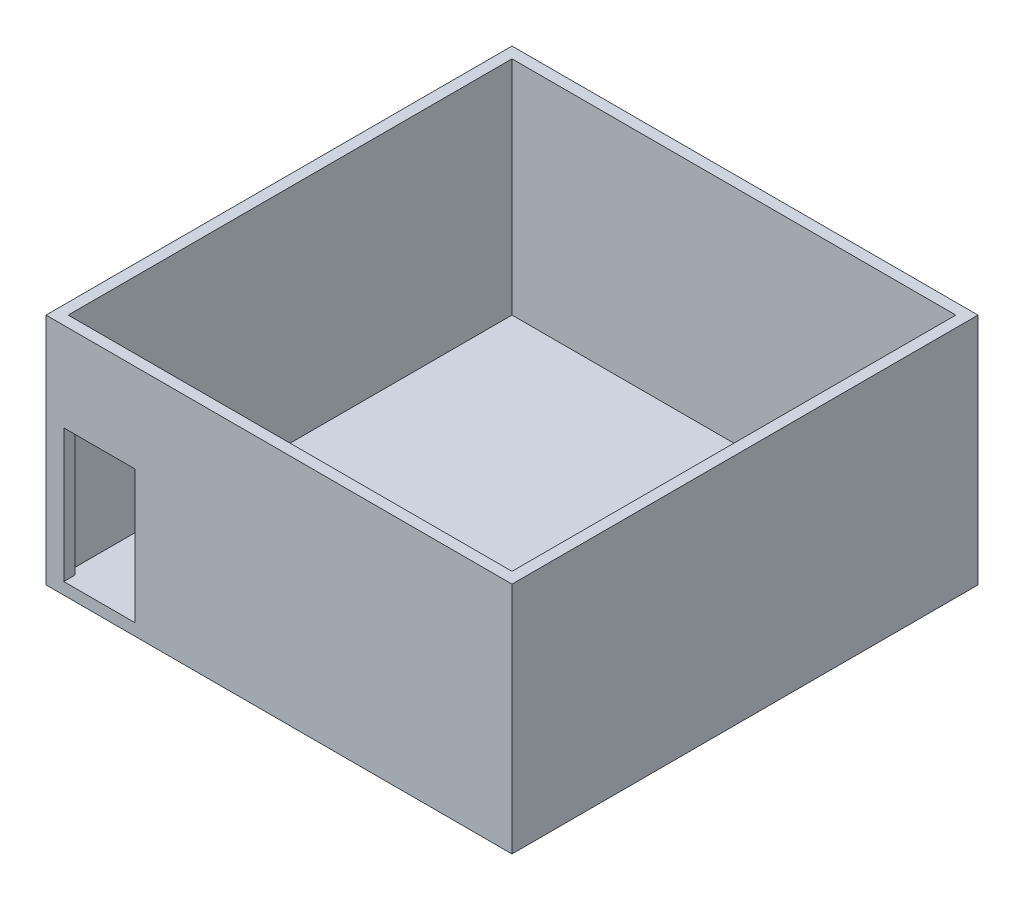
SolidWorks part; units mm, degrees
ref_plane "Ebene vorne" through (0, 0, 0) normal (0, 0, 1) x (1, 0, 0)
ref_plane "Ebene oben" through (0, 0, 0) normal (0, 1, 0) x (1, 0, 0)
ref_plane "Ebene rechts" through (0, 0, 0) normal (1, 0, 0) x (0, 0, -1)
sketch "Skizze1" plane through (0, 0, 0) normal (0, 1, 0) x (1, 0, 0)
  line L0 (0, 0) -> (0, 10000)
  line L1 (0, 10000) -> (-10000, 10000)
  line L2 (-10000, 10000) -> (-10000, 0)
  line L3 (-10000, 0) -> (0, 0)
  line L4 (250, -250) -> (250, 10250)
  line L5 (250, 10250) -> (-10250, 10250)
  line L6 (-10250, 10250) -> (-10250, -250)
  line L7 (-10250, -250) -> (250, -250)
  dimension "D1" = 10000
  dimension "D2" = 10000
  dimension "D3" = 250
extrude "Linear austragen1" add sketch "Skizze1" along normal blind 5000
sketch "Skizze2" plane through (0, 0, 250) normal (0, 0, 1) x (1, 0, 0)
  line L0 (-10250, 5000) -> (-10250, 0) construction
  line L1 (-10250, 0) -> (250, 0)
  line L2 (-10250, 0) -> (-10250, -265.6546)
  line L3 (-10250, -265.6546) -> (250, -265.6546)
  line L4 (250, 0) -> (250, -265.6546)
extrude "Linear austragen2" add sketch "Skizze2" against normal up to surface (10500 mm away)
sketch "Skizze3" plane through (0, 0, 250) normal (0, 0, 1) x (1, 0, 0)
  line L0 (-9850, 0) -> (-9850, 3000)
  line L1 (-10000, 0) -> (0, 0) construction
  line L2 (-9850, 3000) -> (-8250, 3000)
  line L3 (-8250, 3000) -> (-8250, 0)
  line L4 (-8250, 0) -> (-9850, 0)
  line L5 (-10250, 5000) -> (-10250, -265.6546) construction
  dimension "D1" = 2000
  dimension "D2" = 1600
  dimension "D3" = 3000
extrude "Schnitt-Linear austragen1" cut sketch "Skizze3" against normal up to next
